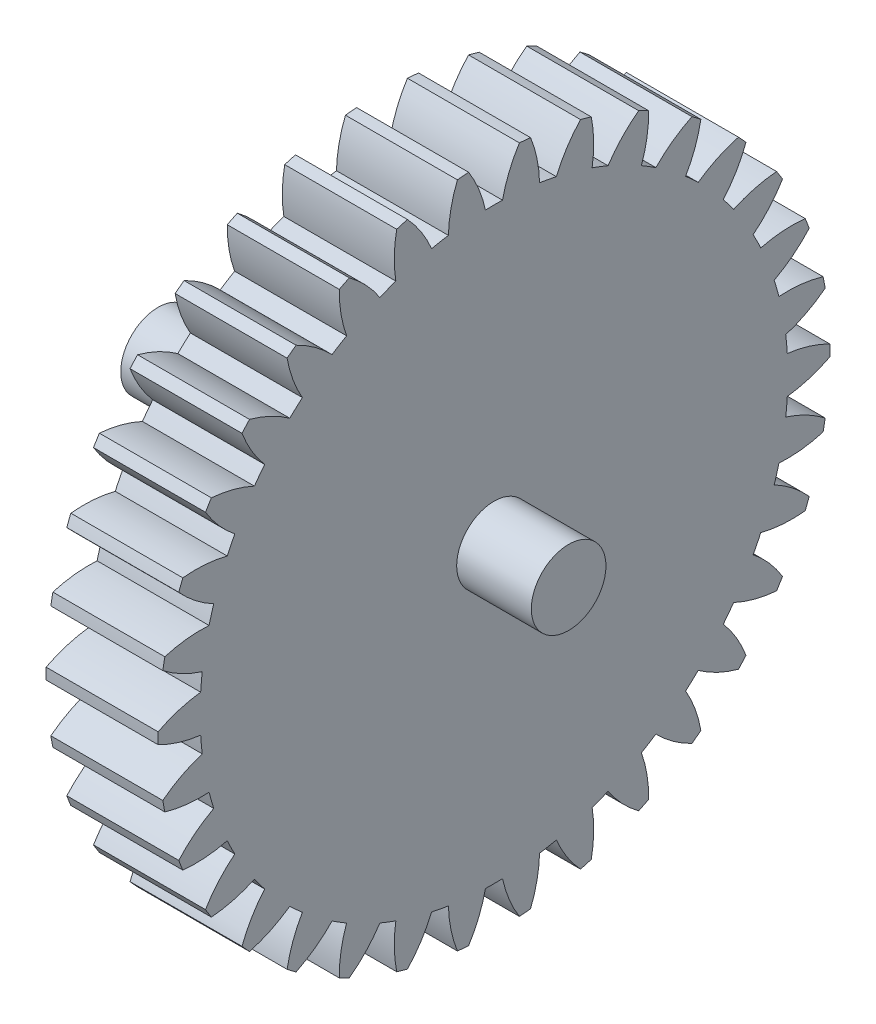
SolidWorks part; units mm, degrees
ref_plane "Plane1" through (0, 0, 0) normal (0, 0, 1) x (1, 0, 0)
ref_plane "Plane2" through (0, 0, 0) normal (0, 1, 0) x (1, 0, 0)
ref_plane "Plane3" through (0, 0, 0) normal (1, 0, 0) x (0, 0, -1)
sketch "HoldingSke" plane through (0, 0, 0) normal (0, 1, 0) x (1, 0, 0)
  line L0 (0, 0) -> (1.6581, -1.1184)
  line L1 (-15, 0) -> (100, 0) construction
  line L2 (0, 0) -> (-2.1039, 2.3779)
  line L3 (0, 0) -> (-11.863, 4.5341)
  line L4 (0, 0) -> (7.1596, 4.8292)
  line L5 (0, 0) -> (-4.2163, -1.5726)
  line L6 (0, 0) -> (-2.4869, -1.6779)
  line L7 (-2.1039, 2.3779) -> (-1.1353, 6.7724)
  line L8 (-76.2, 54.61) -> (-76.1, 54.61)
  line L9 (-71.009, 38.7566) -> (-53.1078, 45.2721)
  line L10 (-76.2, 71.12) -> (104.1128, 71.12)
  line L11 (0, 0) -> (-3, 0)
  line L12 (-76.2, 101.6) -> (-76.181, 101.6)
  line L13 (24.9733, 27.94) -> (52.9518, 28.4284)
  line L14 (24.9733, 27.94) -> (24.9743, 27.94)
  line L15 (24.9733, 27.94) -> (100.4006, 29.5858)
  line L16 (-63.627, -0.5) -> (-12.827, -0.5)
  circle A0 centre (0, 0) radius 0.5
  circle A1 centre (0, 0) radius 5.5
  circle A2 centre (0, 0) radius 5.5
  circle A3 centre (0, 0) radius 0.5
  dimension "MHD" = 11
  dimension "Hub_dia" = 11
  dimension "Bore" = 1
  dimension "MBD" = 1
  dimension "Num_teeth" = 34
  dimension "Pitch_radius" = 180.3128
  dimension "Pitch" = 2
  dimension "Width" = 3
  dimension "Overall_len" = 4.5
  dimension "Show_teeth" = 34
  dimension "Thickness" = 3
  dimension "OAL" = 4.5001
  dimension "T_dim" = 0.1
  dimension "Ap" = 20
  dimension "H" = 19.05
  dimension "Backlash" = 0.019
  dimension "Addendum_fac" = 1
  dimension "Dedendum_fac" = 1.25
  dimension "Clearance_fac" = 0.25
  dimension "Dedendum_add" = 0.001
  dimension "Module" = 0.5
sketch "BasProSke" plane through (0, 0, 0) normal (0, 1, 0) x (1, 0, 0)
  line L0 (-10, 0) -> (60, 0) construction
  line L1 (0, 0) -> (0, 9)
  line L2 (0, 0) -> (3, 0)
  line L3 (3, 0) -> (3, 9)
  line L4 (3, 9) -> (0, 9)
  dimension "Diameter" = 18
  dimension "Thickness" = 3
revolve "Base-Revolve" add sketch "BasProSke" angle 360 about L0
sketch "TooCutSke" plane through (0, 0, 0) normal (1, 0, 0) x (0, 0, -1)
  line L1 (0, 0) -> (0, 107) construction
  line L2 (0, 0) -> (-0.4258, 8.4893) construction
  line L3 (0, 0) -> (-1.5672, 16.9124) construction
  line L4 (-0.4258, 8.4893) -> (-0.7836, 8.4562) construction
  arc A0 (0.229, 7.8707) -> (-0.229, 7.8707) centre (0, 0) ccw
  arc A1 (0.6964, 8.9985) -> (-0.6964, 8.9985) centre (0, 0) ccw
  circle A2 centre (0, 0) radius 8.5 construction
  circle A3 centre (0, 0) radius 7.9874 construction
  arc A4 (-0.229, 7.8707) -> (-0.6964, 8.9985) centre (-3.5525, 7.1539) ccw
  arc A5 (0.6964, 8.9985) -> (0.229, 7.8707) centre (3.5525, 7.1539) ccw
  dimension "Root_dia" = 15.748
  dimension "Overcut_dia" = 18.0508
  dimension "Pitch_dia" = 17
  dimension "Base_dia" = 15.9748
  dimension "Flank_rad" = 3.4
  dimension "Half_ang" = 5.294
  dimension "Half_CT" = 0.3593
extrude "ToothCut" cut sketch "TooCutSke" along normal through all
fillet "Breaks" [suppressed] radius 0.01
fillet "RootFillets" [suppressed] radius 0.126
pattern_circular "TeethCuts" count 34 every 10.588 about axis through (-10, 0, 0) along (1, 0, 0) of "ToothCut", "RootFillets", "Breaks"
sketch "HubNeaOneSke" plane through (0, 0, 0) normal (-1, 0, 0) x (0, 0, 1)
  circle A0 centre (0, 0) radius 5.5
  dimension "Diameter" = 11
extrude "HubNearOne" [suppressed] add sketch "HubNeaOneSke" along normal blind 1.5001
sketch "HubNeaBotSke" plane through (0, 0, 0) normal (-1, 0, 0) x (0, 0, 1)
  circle A0 centre (0, 0) radius 5.5
  dimension "Diameter" = 11
extrude "HubNearBoth" [suppressed] add sketch "HubNeaBotSke" along normal blind 0.75
ref_plane "FarPln" through (3, 0, 0) normal (1, 0, 0) x (0, 0, -1)
sketch "HubFarSke" plane through (3, 0, 0) normal (1, 0, 0) x (0, 0, -1)
  circle A0 centre (0, 0) radius 5.5
  dimension "Diameter" = 11
extrude "HubFar" [suppressed] add sketch "HubFarSke" along normal blind 0.75
sketch "BorSke" plane through (0, 0, 0) normal (1, 0, 0) x (0, 0, -1)
  circle A0 centre (0, 0) radius 0.5
  dimension "Diameter" = 1
extrude "Bore" cut sketch "BorSke" along normal mid plane 9.0001
sketch "KeySke" plane through (0, 0, 0) normal (1, 0, 0) x (0, 0, -1)
  line L0 (-0.05, 0) -> (-0.05, 0.6)
  line L1 (-0.05, 0.6) -> (0.05, 0.6)
  line L2 (0.05, 0.6) -> (0.05, 0)
  line L3 (0, 0) -> (0, 34) construction
  line L4 (-0.05, 0) -> (0.05, 0)
  dimension "Offset" = 0.6
  dimension "Width" = 0.1
extrude "Keyway" [suppressed] cut sketch "KeySke" along normal mid plane 9.0001
pattern_circular "Keyway2" [suppressed] count 2 every 90 about axis through (-10, 0, 0) along (1, 0, 0)
sketch "ｽｹｯﾁ1" plane through (3, 0, 0) normal (1, 0, 0) x (0, 0, -1)
  circle A0 centre (0, 0) radius 1
  dimension "D1" = 2
extrude "押し出し1" add sketch "ｽｹｯﾁ1" along normal blind 2 and the other way blind 9
equation "' \"Module@HoldingSke\" = 6.35"
equation "' \"Num_teeth@HoldingSke\" = 12"
equation "' \"Ap@HoldingSke\" =  20"
equation "' \"Width@HoldingSke\" = 0.5 * 25.4"
equation "' \"Hub_dia@HoldingSke\"= 1 * 25.4"
equation "' \"Overall_len@HoldingSke\" = 1.0 * 25.4"
equation "' \"Bore@HoldingSke\" = 0.75 * 25.4"
equation "' \"T_dim@HoldingSke\" = 0.1 * 25.4"
equation "' \"Width@KeySke\" = 0.25 * 25.4"
equation "' \"Show_teeth@HoldingSke\" = 13"
equation "' \"Backlash@HoldingSke\" = 0.009 * 25.4"
equation "' \"Addendum_fac@HoldingSke\" = 1.0"
equation "' \"Dedendum_fac@HoldingSke\" = 1.25"
equation "' \"Dedendum_add@HoldingSke\" = 0.00005 * 25.4"
equation "' \"Clearance_fac@HoldingSke\" = 0.25"
equation "\"Pitch@HoldingSke\" = 1 / \"Module@HoldingSke\""
equation "\"Overcut_dia@TooCutSke\" = (\"Num_teeth@HoldingSke\" + 2 * \"Addendum_fac@HoldingSke\") / \"Pitch@HoldingSke\" + 0.002 * 25.4"
equation "\"Pitch_dia@TooCutSke\" = \"Num_teeth@HoldingSke\" / \"Pitch@HoldingSke\""
equation "\"Base_dia@TooCutSke\" = \"Num_teeth@HoldingSke\" / \"Pitch@HoldingSke\" * cos((\"Ap@HoldingSke\"  * 3.14159265 / 180))"
equation "\"Root_dia@TooCutSke\" = (\"Num_teeth@HoldingSke\" + 2) / \"Pitch@HoldingSke\" - 2 * (\"Addendum_fac@HoldingSke\" + \"Dedendum_fac@HoldingSke\") / \"Pitch@HoldingSke\" - \"Dedendum_add@HoldingSke\" * 2"
equation "\"Half_ang@TooCutSke\" = 180 / \"Num_teeth@HoldingSke\""
equation "\"Half_CT@TooCutSke\" = \"Num_teeth@HoldingSke\" / \"Pitch@HoldingSke\" * sin((3.14159265 / 2 / \"Num_teeth@HoldingSke\")) / 2 - 7 * \"Backlash@HoldingSke\" / 4"
equation "\"Flank_rad@TooCutSke\" = \"Num_teeth@HoldingSke\" / \"Pitch@HoldingSke\" / 5"
equation "\"Radius@RootFillets\" = \"Clearance_fac@HoldingSke\" / \"Pitch@HoldingSke\" + \"Dedendum_add@HoldingSke\""
equation "\"Break_rad@Breaks\" = 0.02 / \"Pitch@HoldingSke\""
equation "\"Thickness@HoldingSke\" = \"Width@HoldingSke\""
equation "\"OAL@HoldingSke\" = \"Thickness@HoldingSke\""
equation "\"MHD@HoldingSke\" = (\"Num_teeth@HoldingSke\" + 2) / \"Pitch@HoldingSke\" - 2 * (\"Addendum_fac@HoldingSke\" + \"Dedendum_fac@HoldingSke\")  / \"Pitch@HoldingSke\" - \"Dedendum_add@HoldingSke\" * 2"
equation "\"MBD@HoldingSke\" = (\"Num_teeth@HoldingSke\" + 2) / \"Pitch@HoldingSke\" - 2 * (\"Addendum_fac@HoldingSke\" + \"Dedendum_fac@HoldingSke\")  / \"Pitch@HoldingSke\" - \"Dedendum_add@HoldingSke\" * 2 - 0.002 * 25.4"
equation "\"MHD@HoldingSke\" = ((sgn( \"MHD@HoldingSke\" - \"Hub_dia@HoldingSke\" )-1)*( \"MHD@HoldingSke\" - \"Hub_dia@HoldingSke\" ))/-2+ \"Hub_dia@HoldingSke\""
equation "\"MBD@HoldingSke\" = ((sgn( \"MBD@HoldingSke\" - \"Bore@HoldingSke\" )-1)*( \"MBD@HoldingSke\" - \"Bore@HoldingSke\" ))/-2+ \"Bore@HoldingSke\""
equation "\"OAL@HoldingSke\" = ((sgn( \"OAL@HoldingSke\" - \"Overall_len@HoldingSke\" )+1)*( \"OAL@HoldingSke\" - \"Overall_len@HoldingSke\" ))/2 + \"Overall_len@HoldingSke\" + 0.000002 * 25.4"
equation "\"Num_teeth@TeethCuts\" = int( \"Show_teeth@HoldingSke\" ) + 1"
equation "\"Num_teeth@TeethCuts\" = ((sgn( \"Num_teeth@TeethCuts\" - \"Num_teeth@HoldingSke\" )-1)*( \"Num_teeth@TeethCuts\" - \"Num_teeth@HoldingSke\" ))/-2+ \"Num_teeth@HoldingSke\""
equation "\"Num_teeth@TeethCuts\" = ((sgn( \"Num_teeth@TeethCuts\" - 2.0)+1)*( \"Num_teeth@TeethCuts\" - 2.0))/2 +2.0"
equation "\"Angle@TeethCuts\" = 360.0 / \"Num_teeth@HoldingSke\""
equation "\"Diameter@BasProSke\" = (\"Num_teeth@HoldingSke\" + 2 * \"Addendum_fac@HoldingSke\") / \"Pitch@HoldingSke\""
equation "\"Thickness@BasProSke\"  = \"Thickness@HoldingSke\""
equation "' \"Fillet_rad@BasProSke\" =  \"Thickness@HoldingSke\" * 0.05"
equation "\"MHD@HoldingSke\" = ((sgn( \"MHD@HoldingSke\" - \"Root_dia@TooCutSke\" )-1)*( \"MHD@HoldingSke\" - \"Root_dia@TooCutSke\" ))/-2+ \"Root_dia@TooCutSke\""
equation "\"Diameter@HubNeaOneSke\" = \"MHD@HoldingSke\""
equation "\"Length@HubNearOne\" = \"OAL@HoldingSke\" - \"Thickness@BasProSke\""
equation "\"Diameter@HubNeaBotSke\" = \"MHD@HoldingSke\""
equation "\"Length@HubNearBoth\" = ( \"OAL@HoldingSke\" - \"Thickness@BasProSke\" ) / 2.0"
equation "\"Thickness@FarPln\" = \"Thickness@BasProSke\""
equation "\"Diameter@HubFarSke\" = \"MHD@HoldingSke\""
equation "\"Length@HubFar\" = ( \"OAL@HoldingSke\" - \"Thickness@BasProSke\" ) / 2.0"
equation "\"Diameter@BorSke\" = \"MBD@HoldingSke\""
equation "\"D1@Bore\" = \"OAL@HoldingSke\" * 2.0"
equation "\"D1@Keyway\" = \"OAL@HoldingSke\" * 2.0"
equation "\"Offset@KeySke\" = \"T_dim@HoldingSke\" + \"MBD@HoldingSke\" / 2.0"
